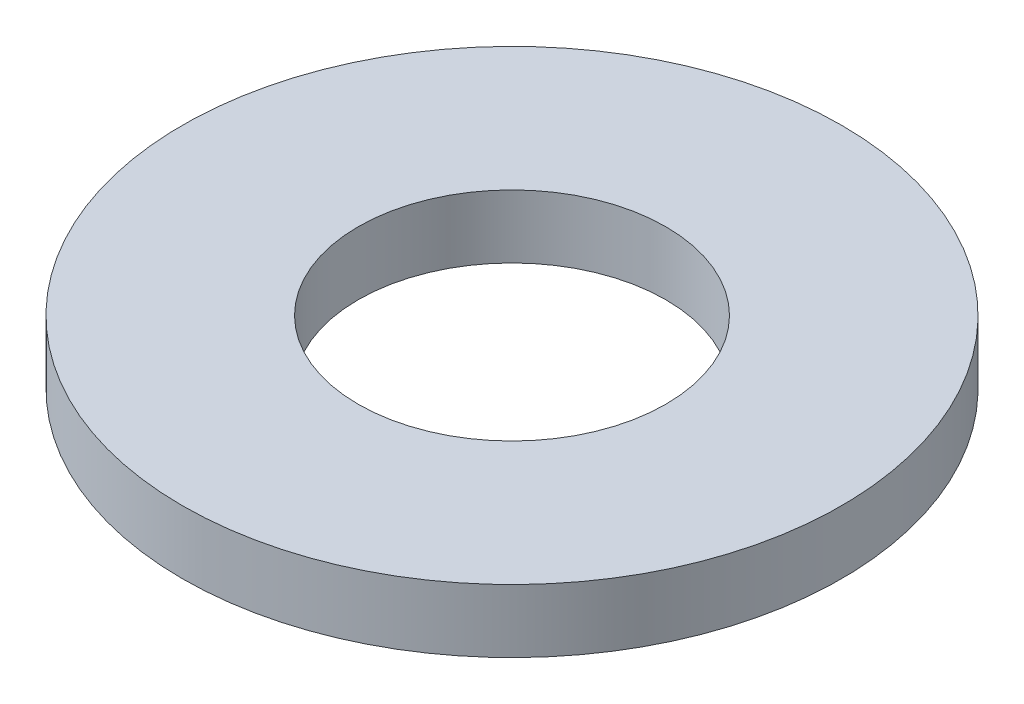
SolidWorks part; units mm, degrees
ref_plane "Front Plane" through (0, 0, 0) normal (0, 0, 1) x (1, 0, 0)
ref_plane "Top Plane" through (0, 0, 0) normal (0, 1, 0) x (1, 0, 0)
ref_plane "Right Plane" through (0, 0, 0) normal (1, 0, 0) x (0, 0, -1)
sketch "Sketch1" plane through (0, 0, 0) normal (0, 1, 0) x (1, 0, 0)
  circle A0 centre (0, 0) radius 4.7625
  dimension "OD" = 9.525
extrude "Boss-Extrude1" add sketch "Sketch1" along normal blind 0.9144
sketch "Sketch5" plane through (0, 0.9144, 0) normal (0, 1, 0) x (-1, 0, 0)
  circle A0 centre (0, 0) radius 2.2225
  dimension "ID" = 4.445
extrude "Cut-Extrude1" cut sketch "Sketch5" against normal through all
